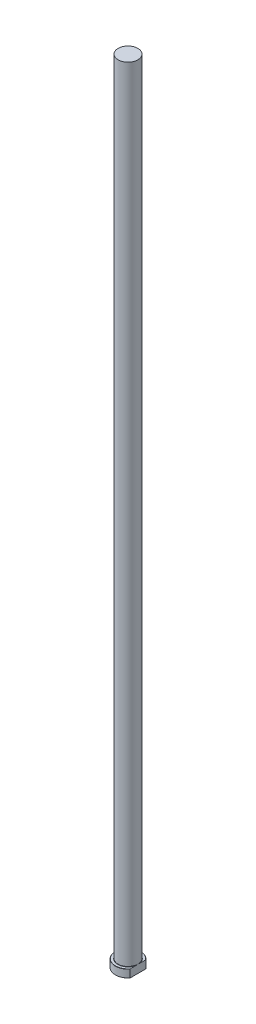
SolidWorks part; units mm, degrees
ref_plane "Front Plane" through (0, 0, 0) normal (0, 0, 1) x (1, 0, 0)
ref_plane "Top Plane" through (0, 0, 0) normal (0, 1, 0) x (1, 0, 0)
ref_plane "Right Plane" through (0, 0, 0) normal (1, 0, 0) x (0, 0, -1)
sketch "Sketch1" plane through (0, 0, 0) normal (0, 0, 1) x (1, 0, 0)
  line L0 (0, 259.9588) -> (0, -15.1925) construction
  line L1 (0, 0) -> (-16, 0)
  line L2 (-16, 0) -> (-16, 10)
  line L3 (-16, 10) -> (-12.5, 10)
  line L4 (-12.5, 10) -> (-12.5, 1000)
  line L5 (-12.5, 1000) -> (0, 1000)
  line L6 (0, 1000) -> (0, 0)
  dimension "L" = 1000
  dimension "H" = 32
  dimension "T" = 10
  dimension "D" = 25
revolve "Revolve1" add sketch "Sketch1" angle 360 about L0
chamfer "Chamfer1" distance 0.2 angle 45 2 edges at (0, 10, 16) (0, 0, 16)
fillet "Fillet1" radius 0.3 1 edges at (0, 10, 12.5)
sketch "Sketch2" plane through (0, 0, 0) normal (0, 1, 0) x (1, 0, 0)
  line L0 (12.5, 9.9875) -> (12.5, -9.9875)
  circle A0 centre (0, 0) radius 16 construction
  arc A1 (12.5, -9.9875) -> (12.5, 9.9875) centre (0, 0) ccw
  circle A2 centre (0, 0) radius 12.5 construction
extrude "KEY" cut sketch "Sketch2" along normal through all
